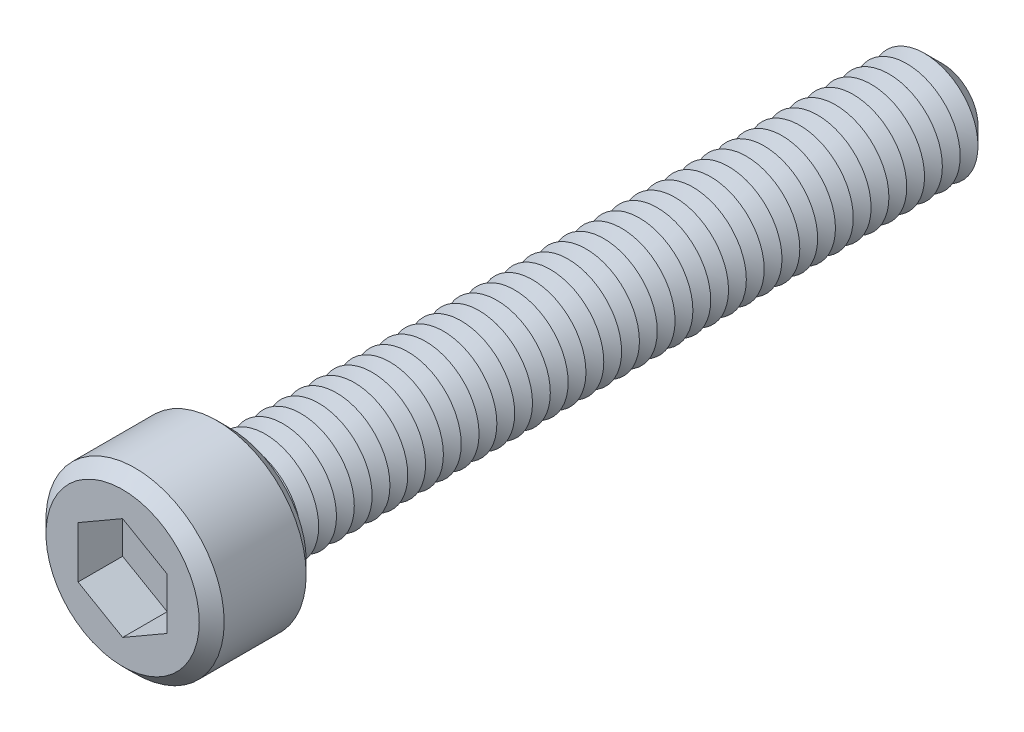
SolidWorks part; units mm, degrees
ref_plane "Front Plane" through (0, 0, 0) normal (0, 0, 1) x (1, 0, 0)
ref_plane "Top Plane" through (0, 0, 0) normal (0, 1, 0) x (1, 0, 0)
ref_plane "Right Plane" through (0, 0, 0) normal (1, 0, 0) x (0, 0, -1)
sketch "Sketch1" plane through (0, 0, 0) normal (0, 0, 1) x (1, 0, 0)
  circle A0 centre (0, 0) radius 5
  dimension "D1" = 10
extrude "Boss-Extrude1" add sketch "Sketch1" along normal blind 6
sketch "Sketch2" plane through (0, 0, 0) normal (0, 0, -1) x (-1, 0, 0)
  circle A0 centre (0, 0) radius 3
  dimension "D1" = 6
extrude "Boss-Extrude2" add sketch "Sketch2" along normal blind 40
chamfer "Chamfer1" distance 1 angle 45 1 edges at (-3, 0, -40)
sketch "Sketch3" plane through (0, 0, 0) normal (1, 0, 0) x (0, 0, -1)
  line L0 (-2.5121, 0) -> (4.5776, 0) construction
sketch "Sketch4" plane through (0, 0, 0) normal (1, 0, 0) x (0, 0, -1)
  line L0 (0, 3) -> (0.5, 2.134)
  line L1 (0.5, 2.134) -> (1, 3)
  line L2 (39, 3) -> (0, 3) construction
  line L3 (1, 3) -> (0, 3)
  dimension "D1" = 1
revolve "Cut-Revolve1" cut sketch "Sketch4" angle 360 about L0
pattern_linear "LPattern1" count 39 spacing 1 along (0, 0, -1) of "Cut-Revolve1"
sketch "Sketch5" plane through (0, 0, 6) normal (0, 0, 1) x (1, 0, 0)
  line L1 (0, 2.8868) -> (-2.5, 1.4434)
  line L2 (-2.5, 1.4434) -> (-2.5, -1.4434)
  line L3 (-2.5, -1.4434) -> (0, -2.8868)
  line L4 (0, -2.8868) -> (2.5, -1.4434)
  line L5 (2.5, -1.4434) -> (2.5, 1.4434)
  line L6 (2.5, 1.4434) -> (0, 2.8868)
  circle A0 centre (0, 0) radius 2.5 construction
  dimension "D1" = 5
extrude "Cut-Extrude1" cut sketch "Sketch5" against normal blind 2.5
sketch "Sketch6" plane through (0, 0, 3.5) normal (0, 0, 1) x (1, 0, 0)
  circle A0 centre (0, 0) radius 0.8
  dimension "D1" = 1.6
extrude "Cut-Extrude2" cut sketch "Sketch6" against normal up to surface (43.5 mm away)
chamfer "Chamfer2" distance 0.7 angle 45 2 edges at (5, 0, 0) (5, 0, 6)
